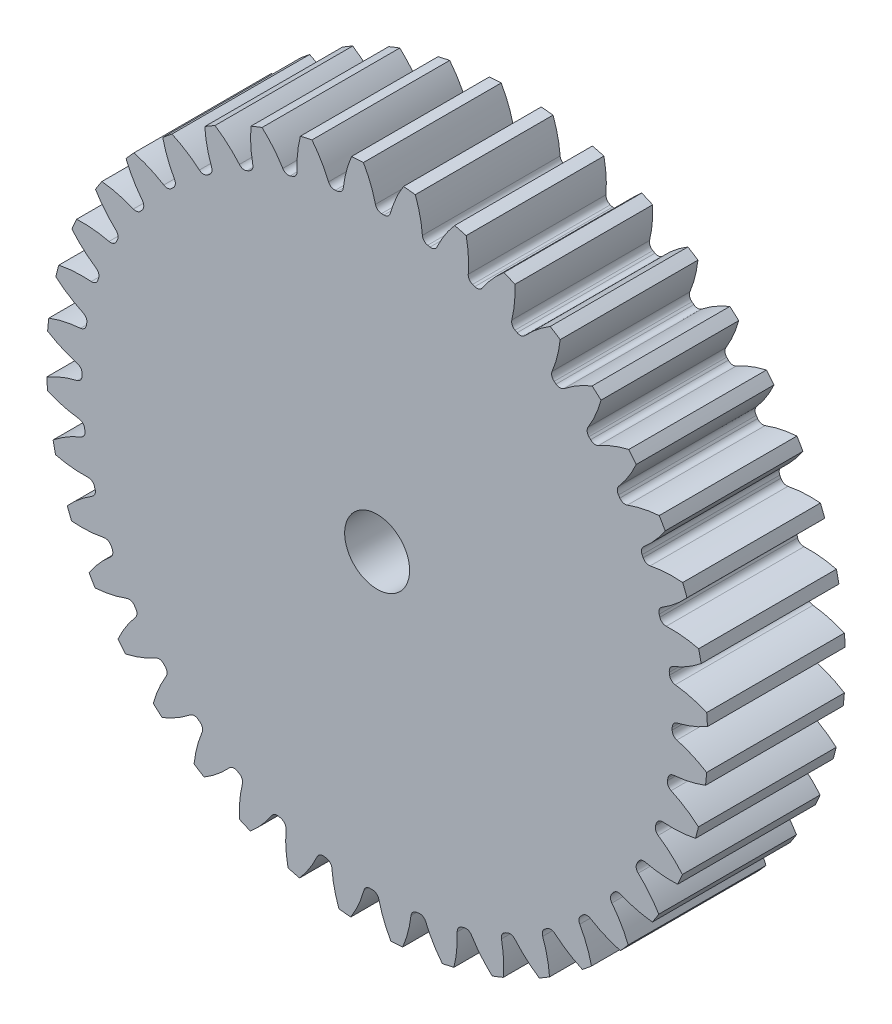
SolidWorks part; units mm, degrees
ref_plane "Front" through (0, 0, 0) normal (0, 0, 1) x (1, 0, 0)
ref_plane "Top" through (0, 0, 0) normal (0, 1, 0) x (1, 0, 0)
ref_plane "Right" through (0, 0, 0) normal (1, 0, 0) x (0, 0, -1)
sketch "Sketch3" plane through (0, 0, 0) normal (0, 0, 1) x (1, 0, 0)
  circle A0 centre (0, 0) radius 213.36
  dimension "od" = 426.72
extrude "gearBody" add sketch "Sketch3" along normal blind 88.9
sketch "Sketch2" plane through (0, 0, 0) normal (0, 0, 1) x (1, 0, 0)
  line L0 (0, 0) -> (176.4107, 73.0717) construction
  line L1 (212.8611, -17.1034) -> (0, 0) construction
  line L2 (0, 0) -> (36.3143, 0) construction
  line L3 (203.1595, 4.0574) -> (202.855, -11.8364) construction
  line L5 (203.0072, -3.8895) -> (0, 0) construction
  line L7 (0, 0) -> (190.9455, 0) construction
  arc A0 (190.9449, 0.496) -> (190.7858, -7.8097) centre (0, 0) ccw construction
  arc A1 (213.1771, 8.8323) -> (212.6823, -16.9915) centre (0, 0) ccw construction
  arc A2 (203.1595, 4.0574) -> (202.855, -11.8364) centre (0, 0) ccw construction
  arc A3 (190.4485, -4.4298) -> (190.4784, -2.8686) centre (0, 0) ccw
  arc A4 (212.8611, -17.1034) -> (193.466, -8.5075) centre (173.4822, -79.7754) ccw
  arc A5 (212.8611, -17.1034) -> (213.36, 8.9373) centre (0, 0) ccw
  arc A6 (213.36, 8.9373) -> (193.6499, 1.0906) centre (176.4107, 73.0717) cw
  arc A7 (190.4784, -2.8686) -> (193.6499, 1.0906) centre (194.6131, -2.9308) cw
  arc A8 (193.466, -8.5075) -> (190.4485, -4.4298) centre (194.5825, -4.5259) cw
  point P6 (213.36, 8.9373)
  point P22 (212.8611, -17.1034)
  dimension "baseDia" = 381.8911
  dimension "od" = 426.72
  dimension "pd" = 406.4
  dimension "rd" = 381
  dimension "rFillet" = 4.1351
  dimension "pointX" = 213.36
  dimension "pointY" = 8.9373
  dimension "CTT" = 15.8937
  dimension "flankCenterAngle" = 22.5
extrude "toothCut" cut sketch "Sketch2" along normal through all
pattern_circular "CirPattern1" count 40 over 360 about axis through (0, 0, 0) along (0, 0, 1) of "toothCut"
sketch "hub1Dia" plane through (0, 0, 0) normal (0, 0, -1) x (-1, 0, 0)
  circle A0 centre (0, 0) radius 12.7
  dimension "hub1Dia" = 25.4
sketch "hub2Dia" plane through (0, 0, 88.9) normal (0, 0, 1) x (1, 0, 0)
  circle A0 centre (0, 0) radius 12.7
  dimension "hub2dia" = 25.4
sketch "boreDia" plane through (0, 0, 0) normal (0, 0, 1) x (1, 0, 0)
  circle A0 centre (0, 0) radius 20.955
  dimension "boreDia" = 41.91
extrude "bore" cut sketch "boreDia" against normal mid plane 25400
